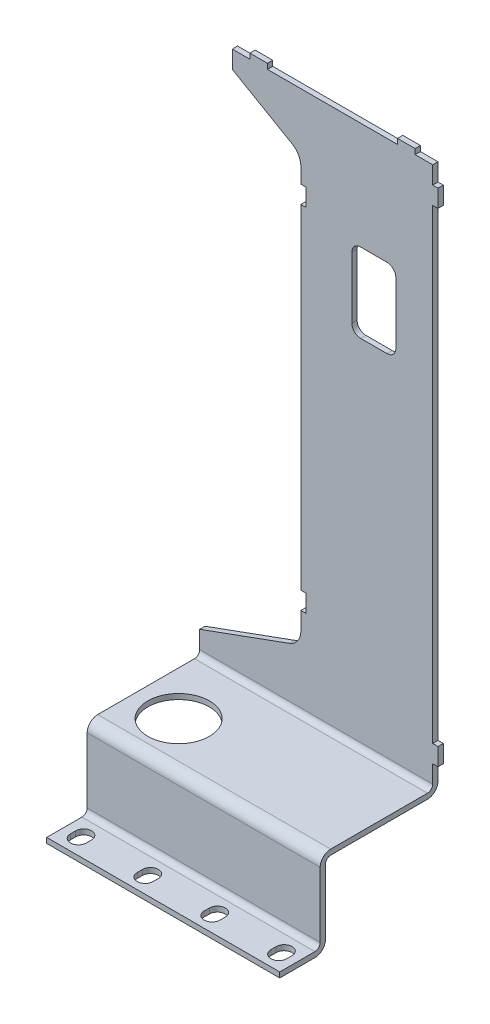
SolidWorks part; units mm, degrees
ref_plane "Спереди" through (0, 0, 0) normal (0, 0, 1) x (1, 0, 0)
ref_plane "Сверху" through (0, 0, 0) normal (0, 1, 0) x (1, 0, 0)
ref_plane "Справа" through (0, 0, 0) normal (1, 0, 0) x (0, 0, -1)
sketch "Эскиз1" plane through (0, 0, 0) normal (0, 0, 1) x (1, 0, 0)
  line L0 (0, 0) -> (0, 49)
  line L1 (0, 49) -> (132.5, 49)
  line L2 (132.5, 0) -> (132.5, 49)
  line L3 (132.5, 0) -> (0, 0)
  dimension "D3" = 132.5
  dimension "D4" = 49
extrude "Бобышка-Вытянуть1" add sketch "Эскиз1" along normal blind 3
sketch "Эскиз2" plane through (0, 0, 0) normal (-1, 0, 0) x (0, 0, 1)
  line L0 (0, 49) -> (0, 0) construction
  line L1 (3, 0) -> (26, 0)
  line L2 (3, 0) -> (3, 3)
  line L3 (3, 3) -> (26, 3)
  line L4 (26, 0) -> (26, 3)
  dimension "D1" = 3
  dimension "D2" = 26
extrude "Бобышка-Вытянуть2" add sketch "Эскиз2" against normal up to surface (132.5 mm away)
fillet "Скругление1" radius 3 1 edges at (66.25, 3, 3)
fillet "Скругление2" radius 6 1 edges at (66.25, 0, 0)
sketch "Эскиз3" plane through (0, 0, 0) normal (0, -1, 0) x (1, 0, 0)
  line L0 (9.5, 14.5) -> (9.5, 17.5) construction
  line L1 (5, 14.5) -> (5, 17.5)
  line L2 (14, 14.5) -> (14, 17.5)
  line L3 (0, 26) -> (0, 6) construction
  line L4 (132.5, 26) -> (0, 26) construction
  arc A0 (5, 14.5) -> (14, 14.5) centre (9.5, 14.5) ccw
  arc A1 (14, 17.5) -> (5, 17.5) centre (9.5, 17.5) ccw
  point P2 (9.5, 16)
  dimension "D3" = 12
  dimension "D1" = 9.5
  dimension "D2" = 10
extrude "Вырез-Вытянуть1" cut sketch "Эскиз3" against normal through all
pattern_linear "Линейный массив1" count 4 spacing 38 along (1, 0, 0) of "Вырез-Вытянуть1"
sketch "Эскиз4" plane through (132.5, 0, 0) normal (1, 0, 0) x (0, 0, -1)
  line L0 (-3, 6) -> (-3, 49) construction
  line L1 (0, 49) -> (61, 49)
  line L2 (0, 49) -> (0, 46)
  line L3 (0, 46) -> (64, 46)
  line L6 (64, 46) -> (64, 357)
  line L7 (64, 357) -> (61, 357)
  line L8 (61, 49) -> (61, 357)
  dimension "D1" = 3
  dimension "D2" = 3
  dimension "D3" = 67
  dimension "D4" = 311
extrude "Бобышка-Вытянуть3" add sketch "Эскиз4" against normal up to surface (132.5 mm away)
fillet "Скругление3" radius 3 2 edges at (66.25, 49, -61) (66.25, 46, 0)
fillet "Скругление4" radius 6 2 edges at (66.25, 46, -64) (66.25, 49, 3)
sketch "Эскиз5" plane through (0, 49, 0) normal (0, 1, 0) x (1, 0, 0)
  line L1 (0, 3) -> (0, 58) construction
  line L3 (132.5, -26) -> (0, -26) construction
  circle A0 centre (25, 24) radius 17.5
  dimension "D1" = 35
  dimension "D2" = 25
  dimension "D3" = 50
extrude "Вырез-Вытянуть2" cut sketch "Эскиз5" against normal through all
sketch "Эскиз6" plane through (0, 0, -61) normal (0, 0, 1) x (1, 0, 0)
  line L0 (0, 52) -> (0, 357) construction
  line L1 (0, 357) -> (57.5, 357)
  line L2 (0, 357) -> (0, 62)
  line L4 (57.5, 357) -> (57.5, 82.9283)
  line L5 (57.5, 82.9283) -> (0, 62)
  dimension "D1" = 57.5
  dimension "D2" = 295
  dimension "D3" = 70
extrude "Вырез-Вытянуть3" cut sketch "Эскиз6" against normal through all
sketch "Эскиз7" plane through (0, 0, -64) normal (0, 0, -1) x (-1, 0, 0)
  line L1 (-57.5, 357) -> (-18.5, 357)
  line L2 (-57.5, 357) -> (-57.5, 324.4833)
  line L3 (-57.5, 324.4833) -> (-18.5, 347)
  line L4 (-18.5, 357) -> (-18.5, 347)
  dimension "D1" = 10
  dimension "D2" = 39
  dimension "D3" = 30
extrude "Бобышка-Вытянуть4" add sketch "Эскиз7" against normal up to surface (3 mm away)
sketch "Эскиз9" plane through (0, 0, -61) normal (0, 0, 1) x (1, 0, 0)
  line L0 (132.5, 357) -> (132.5, 52) construction
  line L1 (132.5, 347) -> (135.5, 347)
  line L2 (132.5, 347) -> (132.5, 337)
  line L3 (132.5, 337) -> (135.5, 337)
  line L4 (135.5, 347) -> (135.5, 337)
  line L5 (132.5, 342) -> (148.87, 342) construction
  line L6 (18.5, 357) -> (132.5, 357) construction
  line L7 (132.5, 67) -> (153.5969, 67) construction
  line L8 (132.5, 72) -> (135.5, 72)
  line L9 (132.5, 72) -> (132.5, 62)
  line L10 (132.5, 62) -> (135.5, 62)
  line L11 (135.5, 72) -> (135.5, 62)
  dimension "D1" = 3
  dimension "D2" = 10
  dimension "D3" = 15
  dimension "D4" = 275
extrude "Бобышка-Вытянуть5" add sketch "Эскиз9" against normal up to surface (3 mm away)
sketch "Эскиз10" plane through (0, 0, -61) normal (0, 0, 1) x (1, 0, 0)
  line L0 (18.5, 357) -> (132.5, 357) construction
  line L1 (28.5, 357) -> (38.5, 357)
  line L2 (28.5, 357) -> (28.5, 360)
  line L3 (28.5, 360) -> (38.5, 360)
  line L4 (38.5, 357) -> (38.5, 360)
  line L5 (33.5, 357) -> (33.5, 374.4457) construction
  line L6 (18.5, 347) -> (18.5, 357) construction
  line L7 (117.5, 357) -> (117.5, 380.0282) construction
  line L8 (112.5, 357) -> (122.5, 357)
  line L9 (112.5, 357) -> (112.5, 360)
  line L10 (112.5, 360) -> (122.5, 360)
  line L11 (122.5, 357) -> (122.5, 360)
  line L12 (132.5, 357) -> (132.5, 347) construction
  dimension "D1" = 10
  dimension "D2" = 3
  dimension "D3" = 15
  dimension "D4" = 15
extrude "Бобышка-Вытянуть6" add sketch "Эскиз10" against normal up to surface (3 mm away)
fillet "Скругление5" radius 10 1 edges at (57.5, 82.9283, -62.5)
fillet "Скругление7" radius 10 1 edges at (57.5, 324.4833, -62.5)
sketch "Эскиз11" plane through (0, 0, -64) normal (0, 0, -1) x (-1, 0, 0)
  line L0 (-57.5, 89.9304) -> (-57.5, 318.7098) construction
  line L1 (-57.5, 310) -> (-60.5, 310)
  line L2 (-57.5, 310) -> (-57.5, 300)
  line L3 (-57.5, 300) -> (-60.5, 300)
  line L4 (-60.5, 310) -> (-60.5, 300)
  line L5 (-60.5, 305) -> (-36.127, 305) construction
  line L6 (-38.5, 357) -> (-112.5, 357) construction
  line L7 (-60.5, 105) -> (-19.4723, 105) construction
  line L8 (-60.5, 110) -> (-57.5, 110)
  line L9 (-60.5, 110) -> (-60.5, 100)
  line L10 (-60.5, 100) -> (-57.5, 100)
  line L11 (-57.5, 110) -> (-57.5, 100)
  dimension "D1" = 3
  dimension "D2" = 10
  dimension "D3" = 52
  dimension "D4" = 200
extrude "Вырез-Вытянуть4" cut sketch "Эскиз11" against normal through all
sketch "Эскиз12" plane through (0, 0, -64) normal (0, 0, -1) x (-1, 0, 0)
  line L0 (-99, 296) -> (-99, 251) construction
  line L1 (-111.5, 296) -> (-86.5, 296)
  line L2 (-111.5, 296) -> (-111.5, 251)
  line L3 (-111.5, 251) -> (-86.5, 251)
  line L4 (-86.5, 296) -> (-86.5, 251)
  line L7 (-111.5, 273.5) -> (-153.4736, 273.5) construction
  line L9 (-132.5, 72) -> (-132.5, 337) construction
  line L10 (-38.5, 357) -> (-112.5, 357) construction
  dimension "D1" = 25
  dimension "D2" = 45
  dimension "D3" = 21
  dimension "D4" = 61
  dimension "D5" = 83.5
  dimension "D6" = 33.5
extrude "Вырез-Вытянуть5" cut sketch "Эскиз12" against normal through all
fillet "Скругление8" radius 5 4 edges at (86.5, 296, -62.5) (111.5, 251, -62.5) (86.5, 251, -62.5) (111.5, 296, -62.5)
